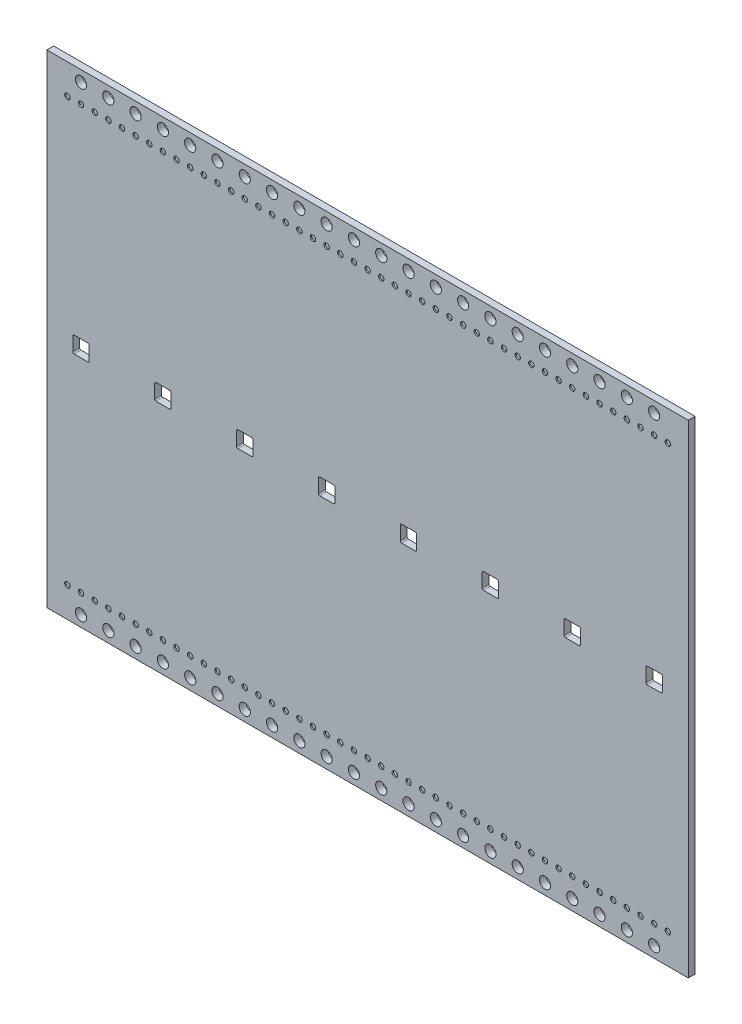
SolidWorks part; units mm, degrees
ref_plane "前视基准面" through (0, 0, 0) normal (0, 0, 1) x (1, 0, 0)
ref_plane "上视基准面" through (0, 0, 0) normal (0, 1, 0) x (1, 0, 0)
ref_plane "右视基准面" through (0, 0, 0) normal (1, 0, 0) x (0, 0, -1)
sketch "草图1" plane through (0, 0, 0) normal (0, 0, 1) x (1, 0, 0)
  line L0 (-117.5, 88.5) -> (117.5, 88.5)
  line L1 (117.5, -88.5) -> (-117.5, -88.5)
  line L2 (-117.5, -88.5) -> (-117.5, 88.5)
  line L3 (117.5, 88.5) -> (117.5, -88.5)
  line L4 (117.5, 88.5) -> (-117.5, -88.5) construction
  circle A0 centre (-105, 84.5) radius 2.05
  circle A1 centre (-95, 84.5) radius 2.05
  circle A2 centre (-95, -84.5) radius 2.05
  circle A3 centre (-85, 84.5) radius 2.05
  circle A4 centre (-85, -84.5) radius 2.05
  circle A5 centre (-75, 84.5) radius 2.05
  circle A6 centre (-75, -84.5) radius 2.05
  circle A7 centre (-65, 84.5) radius 2.05
  circle A8 centre (-65, -84.5) radius 2.05
  circle A9 centre (-55, 84.5) radius 2.05
  circle A10 centre (-55, -84.5) radius 2.05
  circle A11 centre (-45, 84.5) radius 2.05
  circle A12 centre (-45, -84.5) radius 2.05
  circle A13 centre (-35, 84.5) radius 2.05
  circle A14 centre (-35, -84.5) radius 2.05
  circle A15 centre (-25, 84.5) radius 2.05
  circle A16 centre (-25, -84.5) radius 2.05
  circle A17 centre (-15, 84.5) radius 2.05
  circle A18 centre (-15, -84.5) radius 2.05
  circle A19 centre (-5, 84.5) radius 2.05
  circle A20 centre (-5, -84.5) radius 2.05
  circle A21 centre (5, 84.5) radius 2.05
  circle A22 centre (5, -84.5) radius 2.05
  circle A23 centre (15, 84.5) radius 2.05
  circle A24 centre (15, -84.5) radius 2.05
  circle A25 centre (25, 84.5) radius 2.05
  circle A26 centre (25, -84.5) radius 2.05
  circle A27 centre (35, 84.5) radius 2.05
  circle A28 centre (35, -84.5) radius 2.05
  circle A29 centre (45, 84.5) radius 2.05
  circle A30 centre (45, -84.5) radius 2.05
  circle A31 centre (55, 84.5) radius 2.05
  circle A32 centre (55, -84.5) radius 2.05
  circle A33 centre (65, 84.5) radius 2.05
  circle A34 centre (65, -84.5) radius 2.05
  circle A35 centre (75, 84.5) radius 2.05
  circle A36 centre (75, -84.5) radius 2.05
  circle A37 centre (85, 84.5) radius 2.05
  circle A38 centre (85, -84.5) radius 2.05
  circle A39 centre (95, 84.5) radius 2.05
  circle A40 centre (95, -84.5) radius 2.05
  circle A41 centre (105, 84.5) radius 2.05
  circle A42 centre (105, -84.5) radius 2.05
  circle A52 centre (-105, -84.5) radius 2.05
extrude "凸台-拉伸1" add sketch "草图1" along normal mid plane 2.5
sketch "草图2" plane through (0, 0, 1.25) normal (0, 0, 1) x (1, 0, 0)
  line L0 (117.5, 88.5) -> (-117.5, 88.5) construction
  line L1 (-117.5, -88.5) -> (117.5, -88.5) construction
  circle A0 centre (-110, 77.5) radius 1
  circle A2 centre (-105, 84.5) radius 2.05 construction
  circle A3 centre (-110, -77.5) radius 1
  circle A4 centre (-105, 77.5) radius 1
  circle A5 centre (-105, -77.5) radius 1
  circle A6 centre (-100, 77.5) radius 1
  circle A7 centre (-100, -77.5) radius 1
  circle A8 centre (-95, 77.5) radius 1
  circle A9 centre (-95, -77.5) radius 1
  circle A10 centre (-90, 77.5) radius 1
  circle A11 centre (-90, -77.5) radius 1
  circle A12 centre (-85, 77.5) radius 1
  circle A13 centre (-85, -77.5) radius 1
  circle A14 centre (-80, 77.5) radius 1
  circle A15 centre (-80, -77.5) radius 1
  circle A16 centre (-75, 77.5) radius 1
  circle A17 centre (-75, -77.5) radius 1
  circle A18 centre (-70, 77.5) radius 1
  circle A19 centre (-70, -77.5) radius 1
  circle A20 centre (-65, 77.5) radius 1
  circle A21 centre (-65, -77.5) radius 1
  circle A22 centre (-60, 77.5) radius 1
  circle A23 centre (-60, -77.5) radius 1
  circle A24 centre (-55, 77.5) radius 1
  circle A25 centre (-55, -77.5) radius 1
  circle A26 centre (-50, 77.5) radius 1
  circle A27 centre (-50, -77.5) radius 1
  circle A28 centre (-45, 77.5) radius 1
  circle A29 centre (-45, -77.5) radius 1
  circle A30 centre (-40, 77.5) radius 1
  circle A31 centre (-40, -77.5) radius 1
  circle A32 centre (-35, 77.5) radius 1
  circle A33 centre (-35, -77.5) radius 1
  circle A34 centre (-30, 77.5) radius 1
  circle A35 centre (-30, -77.5) radius 1
  circle A36 centre (-25, 77.5) radius 1
  circle A37 centre (-25, -77.5) radius 1
  circle A38 centre (-20, 77.5) radius 1
  circle A39 centre (-20, -77.5) radius 1
  circle A40 centre (-15, 77.5) radius 1
  circle A41 centre (-15, -77.5) radius 1
  circle A42 centre (-10, 77.5) radius 1
  circle A43 centre (-10, -77.5) radius 1
  circle A44 centre (-5, 77.5) radius 1
  circle A45 centre (-5, -77.5) radius 1
  circle A46 centre (0, 77.5) radius 1
  circle A47 centre (0, -77.5) radius 1
  circle A48 centre (5, 77.5) radius 1
  circle A49 centre (5, -77.5) radius 1
  circle A50 centre (10, 77.5) radius 1
  circle A51 centre (10, -77.5) radius 1
  circle A52 centre (15, 77.5) radius 1
  circle A53 centre (15, -77.5) radius 1
  circle A54 centre (20, 77.5) radius 1
  circle A55 centre (20, -77.5) radius 1
  circle A56 centre (25, 77.5) radius 1
  circle A57 centre (25, -77.5) radius 1
  circle A58 centre (30, 77.5) radius 1
  circle A59 centre (30, -77.5) radius 1
  circle A60 centre (35, 77.5) radius 1
  circle A61 centre (35, -77.5) radius 1
  circle A62 centre (40, 77.5) radius 1
  circle A63 centre (40, -77.5) radius 1
  circle A64 centre (45, 77.5) radius 1
  circle A65 centre (45, -77.5) radius 1
  circle A66 centre (50, 77.5) radius 1
  circle A67 centre (50, -77.5) radius 1
  circle A68 centre (55, 77.5) radius 1
  circle A69 centre (55, -77.5) radius 1
  circle A70 centre (60, 77.5) radius 1
  circle A71 centre (60, -77.5) radius 1
  circle A72 centre (65, 77.5) radius 1
  circle A73 centre (65, -77.5) radius 1
  circle A74 centre (70, 77.5) radius 1
  circle A75 centre (70, -77.5) radius 1
  circle A76 centre (75, 77.5) radius 1
  circle A77 centre (75, -77.5) radius 1
  circle A78 centre (80, 77.5) radius 1
  circle A79 centre (80, -77.5) radius 1
  circle A80 centre (85, 77.5) radius 1
  circle A81 centre (85, -77.5) radius 1
  circle A82 centre (90, 77.5) radius 1
  circle A83 centre (90, -77.5) radius 1
  circle A84 centre (95, 77.5) radius 1
  circle A85 centre (95, -77.5) radius 1
  circle A86 centre (100, 77.5) radius 1
  circle A87 centre (100, -77.5) radius 1
  circle A88 centre (105, 77.5) radius 1
  circle A89 centre (105, -77.5) radius 1
  circle A90 centre (110, 77.5) radius 1
  circle A91 centre (110, -77.5) radius 1
extrude "切除-拉伸1" cut sketch "草图2" against normal blind 0.5
sketch "草图3" plane through (0, 0, -1.25) normal (0, 0, -1) x (-1, 0, 0)
  circle A0 centre (110, 77.5) radius 1
  circle A1 centre (110, -77.5) radius 1
  circle A2 centre (105, 77.5) radius 1
  circle A3 centre (105, -77.5) radius 1
  circle A4 centre (100, 77.5) radius 1
  circle A5 centre (100, -77.5) radius 1
  circle A6 centre (95, 77.5) radius 1
  circle A7 centre (95, -77.5) radius 1
  circle A8 centre (90, 77.5) radius 1
  circle A9 centre (90, -77.5) radius 1
  circle A10 centre (85, 77.5) radius 1
  circle A11 centre (85, -77.5) radius 1
  circle A12 centre (80, 77.5) radius 1
  circle A13 centre (80, -77.5) radius 1
  circle A14 centre (75, 77.5) radius 1
  circle A15 centre (75, -77.5) radius 1
  circle A16 centre (70, 77.5) radius 1
  circle A17 centre (70, -77.5) radius 1
  circle A18 centre (65, 77.5) radius 1
  circle A19 centre (65, -77.5) radius 1
  circle A20 centre (60, 77.5) radius 1
  circle A21 centre (60, -77.5) radius 1
  circle A22 centre (55, 77.5) radius 1
  circle A23 centre (55, -77.5) radius 1
  circle A24 centre (50, 77.5) radius 1
  circle A25 centre (50, -77.5) radius 1
  circle A26 centre (45, 77.5) radius 1
  circle A27 centre (45, -77.5) radius 1
  circle A28 centre (40, 77.5) radius 1
  circle A29 centre (40, -77.5) radius 1
  circle A30 centre (35, 77.5) radius 1
  circle A31 centre (35, -77.5) radius 1
  circle A32 centre (30, 77.5) radius 1
  circle A33 centre (30, -77.5) radius 1
  circle A34 centre (25, 77.5) radius 1
  circle A35 centre (25, -77.5) radius 1
  circle A36 centre (20, 77.5) radius 1
  circle A37 centre (20, -77.5) radius 1
  circle A38 centre (15, 77.5) radius 1
  circle A39 centre (15, -77.5) radius 1
  circle A40 centre (10, 77.5) radius 1
  circle A41 centre (10, -77.5) radius 1
  circle A42 centre (5, 77.5) radius 1
  circle A43 centre (5, -77.5) radius 1
  circle A44 centre (0, 77.5) radius 1
  circle A45 centre (0, -77.5) radius 1
  circle A46 centre (-5, 77.5) radius 1
  circle A47 centre (-5, -77.5) radius 1
  circle A48 centre (-10, 77.5) radius 1
  circle A49 centre (-10, -77.5) radius 1
  circle A50 centre (-15, 77.5) radius 1
  circle A51 centre (-15, -77.5) radius 1
  circle A52 centre (-20, 77.5) radius 1
  circle A53 centre (-20, -77.5) radius 1
  circle A54 centre (-25, 77.5) radius 1
  circle A55 centre (-25, -77.5) radius 1
  circle A56 centre (-30, 77.5) radius 1
  circle A57 centre (-30, -77.5) radius 1
  circle A58 centre (-35, 77.5) radius 1
  circle A59 centre (-35, -77.5) radius 1
  circle A60 centre (-40, 77.5) radius 1
  circle A61 centre (-40, -77.5) radius 1
  circle A62 centre (-45, 77.5) radius 1
  circle A63 centre (-45, -77.5) radius 1
  circle A64 centre (-50, 77.5) radius 1
  circle A65 centre (-50, -77.5) radius 1
  circle A66 centre (-55, 77.5) radius 1
  circle A67 centre (-55, -77.5) radius 1
  circle A68 centre (-60, 77.5) radius 1
  circle A69 centre (-60, -77.5) radius 1
  circle A70 centre (-65, 77.5) radius 1
  circle A71 centre (-65, -77.5) radius 1
  circle A72 centre (-70, 77.5) radius 1
  circle A73 centre (-70, -77.5) radius 1
  circle A74 centre (-75, 77.5) radius 1
  circle A75 centre (-75, -77.5) radius 1
  circle A76 centre (-80, 77.5) radius 1
  circle A77 centre (-80, -77.5) radius 1
  circle A78 centre (-85, 77.5) radius 1
  circle A79 centre (-85, -77.5) radius 1
  circle A80 centre (-90, 77.5) radius 1
  circle A81 centre (-90, -77.5) radius 1
  circle A82 centre (-95, 77.5) radius 1
  circle A83 centre (-95, -77.5) radius 1
  circle A84 centre (-100, 77.5) radius 1
  circle A85 centre (-100, -77.5) radius 1
  circle A86 centre (-105, 77.5) radius 1
  circle A87 centre (-105, -77.5) radius 1
  circle A88 centre (-110, 77.5) radius 1
  circle A89 centre (-110, -77.5) radius 1
extrude "凸台-拉伸2" add sketch "草图3" along normal blind 1
sketch "草图4" plane through (0, 0, 1.25) normal (0, 0, 1) x (1, 0, 0)
  line L0 (-117.5, 88.5) -> (-117.5, -88.5) construction
  line L1 (-107.5, -3) -> (-102.5, -3)
  line L2 (-108, -2.5) -> (-108, 2.5)
  line L3 (-107.5, 3) -> (-102.5, 3)
  line L4 (-102, -2.5) -> (-102, 2.5)
  line L5 (-108, -3) -> (-102, 3) construction
  line L6 (-108, 3) -> (-102, -3) construction
  line L8 (117.5, 88.5) -> (-117.5, 88.5) construction
  line L9 (-117.5, -88.5) -> (117.5, -88.5) construction
  line L10 (-77.5, 3) -> (-72.5, 3)
  line L11 (-78, -2.5) -> (-78, 2.5)
  line L12 (-77.5, -3) -> (-72.5, -3)
  line L13 (-72, -2.5) -> (-72, 2.5)
  line L14 (-47.5, 3) -> (-42.5, 3)
  line L15 (-48, -2.5) -> (-48, 2.5)
  line L16 (-47.5, -3) -> (-42.5, -3)
  line L17 (-42, -2.5) -> (-42, 2.5)
  line L18 (-17.5, 3) -> (-12.5, 3)
  line L19 (-18, -2.5) -> (-18, 2.5)
  line L20 (-17.5, -3) -> (-12.5, -3)
  line L21 (-12, -2.5) -> (-12, 2.5)
  line L22 (12.5, 3) -> (17.5, 3)
  line L23 (12, -2.5) -> (12, 2.5)
  line L24 (12.5, -3) -> (17.5, -3)
  line L25 (18, -2.5) -> (18, 2.5)
  line L26 (42.5, 3) -> (47.5, 3)
  line L27 (42, -2.5) -> (42, 2.5)
  line L28 (42.5, -3) -> (47.5, -3)
  line L29 (48, -2.5) -> (48, 2.5)
  line L30 (72.5, 3) -> (77.5, 3)
  line L31 (72, -2.5) -> (72, 2.5)
  line L32 (72.5, -3) -> (77.5, -3)
  line L33 (78, -2.5) -> (78, 2.5)
  line L34 (102.5, 3) -> (107.5, 3)
  line L35 (102, -2.5) -> (102, 2.5)
  line L36 (102.5, -3) -> (107.5, -3)
  line L37 (108, -2.5) -> (108, 2.5)
  arc A0 (-107.5, 3) -> (-108, 2.5) centre (-107.5, 2.5) ccw
  arc A1 (-108, -2.5) -> (-107.5, -3) centre (-107.5, -2.5) ccw
  arc A2 (-102.5, -3) -> (-102, -2.5) centre (-102.5, -2.5) ccw
  arc A3 (-102, 2.5) -> (-102.5, 3) centre (-102.5, 2.5) ccw
  arc A4 (-77.5, 3) -> (-78, 2.5) centre (-77.5, 2.5) ccw
  arc A5 (-78, -2.5) -> (-77.5, -3) centre (-77.5, -2.5) ccw
  arc A6 (-72.5, -3) -> (-72, -2.5) centre (-72.5, -2.5) ccw
  arc A7 (-72, 2.5) -> (-72.5, 3) centre (-72.5, 2.5) ccw
  arc A8 (-47.5, 3) -> (-48, 2.5) centre (-47.5, 2.5) ccw
  arc A9 (-48, -2.5) -> (-47.5, -3) centre (-47.5, -2.5) ccw
  arc A10 (-42.5, -3) -> (-42, -2.5) centre (-42.5, -2.5) ccw
  arc A11 (-42, 2.5) -> (-42.5, 3) centre (-42.5, 2.5) ccw
  arc A12 (-17.5, 3) -> (-18, 2.5) centre (-17.5, 2.5) ccw
  arc A13 (-18, -2.5) -> (-17.5, -3) centre (-17.5, -2.5) ccw
  arc A14 (-12.5, -3) -> (-12, -2.5) centre (-12.5, -2.5) ccw
  arc A15 (-12, 2.5) -> (-12.5, 3) centre (-12.5, 2.5) ccw
  arc A16 (12.5, 3) -> (12, 2.5) centre (12.5, 2.5) ccw
  arc A17 (12, -2.5) -> (12.5, -3) centre (12.5, -2.5) ccw
  arc A18 (17.5, -3) -> (18, -2.5) centre (17.5, -2.5) ccw
  arc A19 (18, 2.5) -> (17.5, 3) centre (17.5, 2.5) ccw
  arc A20 (42.5, 3) -> (42, 2.5) centre (42.5, 2.5) ccw
  arc A21 (42, -2.5) -> (42.5, -3) centre (42.5, -2.5) ccw
  arc A22 (47.5, -3) -> (48, -2.5) centre (47.5, -2.5) ccw
  arc A23 (48, 2.5) -> (47.5, 3) centre (47.5, 2.5) ccw
  arc A24 (72.5, 3) -> (72, 2.5) centre (72.5, 2.5) ccw
  arc A25 (72, -2.5) -> (72.5, -3) centre (72.5, -2.5) ccw
  arc A26 (77.5, -3) -> (78, -2.5) centre (77.5, -2.5) ccw
  arc A27 (78, 2.5) -> (77.5, 3) centre (77.5, 2.5) ccw
  arc A28 (102.5, 3) -> (102, 2.5) centre (102.5, 2.5) ccw
  arc A29 (102, -2.5) -> (102.5, -3) centre (102.5, -2.5) ccw
  arc A30 (107.5, -3) -> (108, -2.5) centre (107.5, -2.5) ccw
  arc A31 (108, 2.5) -> (107.5, 3) centre (107.5, 2.5) ccw
  point P0 (-105, 0)
  dimension "D6" = 0.5
  dimension "D1" = 9.5
  dimension "D2" = 6
  dimension "D3" = 6
  dimension "D4" = 88.5
  dimension "D5" = 88.5
  dimension "D7" = 8
extrude "切除-拉伸2" cut sketch "草图4" against normal blind 10
equation "\"D4@草图1\"=\"D1@草图1\"/2"
equation "\"D3@草图1\"=\"D2@草图1\"/2"
equation "\"D9@草图1\"=\"D1@草图1\"/10-2"
equation "\"D5@草图2\"=\"D1@草图1\"/5-2"
equation "\"D1@草图3\"=\"D1@草图1\"/5-2"
